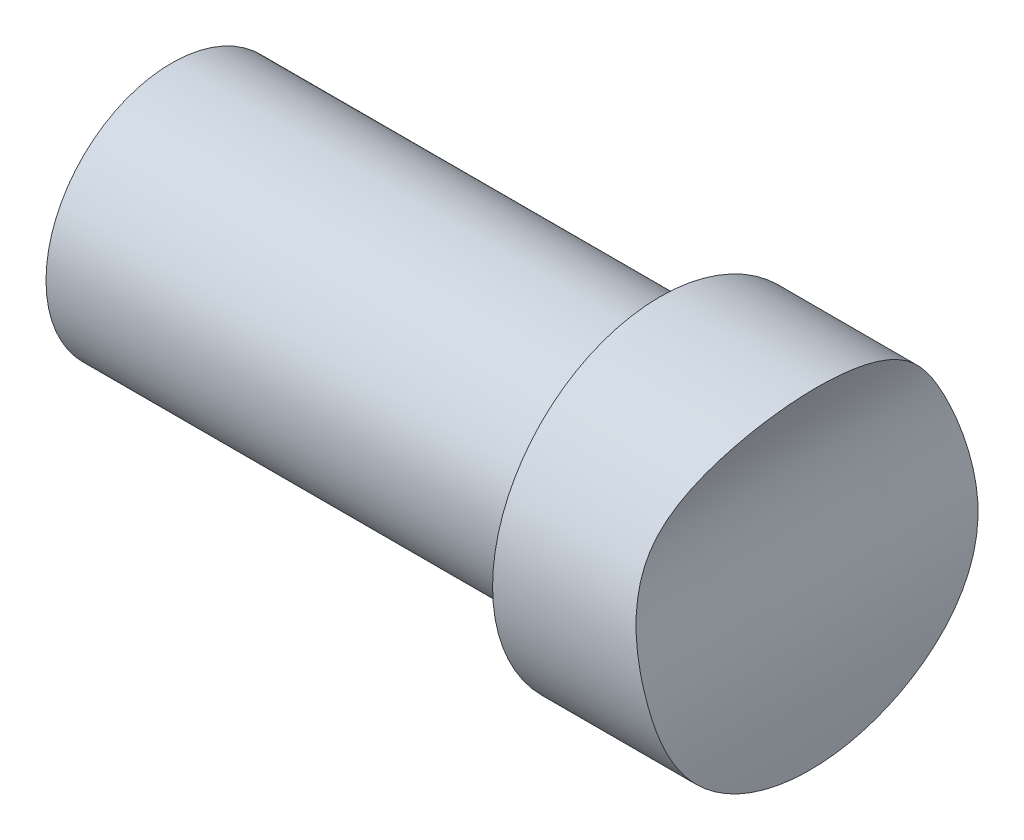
SolidWorks part; units mm, degrees
ref_plane "face" through (0, 0, 0) normal (0, 0, 1) x (1, 0, 0)
ref_plane "dessus" through (0, 0, 0) normal (0, 1, 0) x (1, 0, 0)
ref_plane "profil" through (0, 0, 0) normal (1, 0, 0) x (0, 0, -1)
sketch "Esquisse1" plane through (0, 0, 0) normal (0, 0, 1) x (1, 0, 0)
  line L0 (-8.9958, 0) -> (47, 0) construction
  line L1 (0, 0) -> (0, 9)
  line L2 (0, 9) -> (35, 9)
  line L3 (35, 9) -> (35, 12)
  line L4 (35, 12) -> (47, 12)
  line L5 (47, 12) -> (47, 0)
  line L6 (47, 0) -> (0, 0)
  dimension "D1" = 9
  dimension "D2" = 12
  dimension "D3" = 35
  dimension "D4" = 12
revolve "Base-Révolution" add sketch "Esquisse1" angle 360 about L0
hole_wizard "Perçage1" positions "Esquisse3" profile "Esquisse2" tap size "M8x1.25" standard "ISO"
sketch "Esquisse3" plane through (0, 0, 0) normal (-1, 0, 0) x (0, 0, 1)
  point P0 (0, 0)
sketch "Esquisse2" plane through (0, 0, 0) normal (0, 1, 0) x (0, 0, 1)
  line L0 (0, 0) -> (0, 29.0429)
  line L1 (0, 29.0429) -> (3.4, 27)
  line L2 (3.4, 27) -> (3.4, 0)
  line L5 (3.4, 0) -> (0, 0)
  line L10 (0, 29.0429) -> (-3.4, 27) construction
  line L11 (0, -6.35) -> (0, 107.95) construction
  dimension "Diamètre du perçage" = 6.8
  dimension "Profondeur du perçage" = 27
  dimension "Angle de pointe" = 118
sketch "Esquisse4" plane through (0, 0, 0) normal (0, 0, 1) x (1, 0, 0)
  line L0 (46.4343, 12.4423) -> (48.2502, 12.4423)
  line L1 (48.2502, 12.4423) -> (48.2502, -12.5096)
  line L2 (48.2502, -12.5096) -> (45.6944, -12.5096)
  point P1 (44.6184, 6.6583)
  point P2 (45.8962, -1.6141)
extrude "Enlèv. mat.-Extru.1" cut sketch "Esquisse4" against normal mid plane 30
